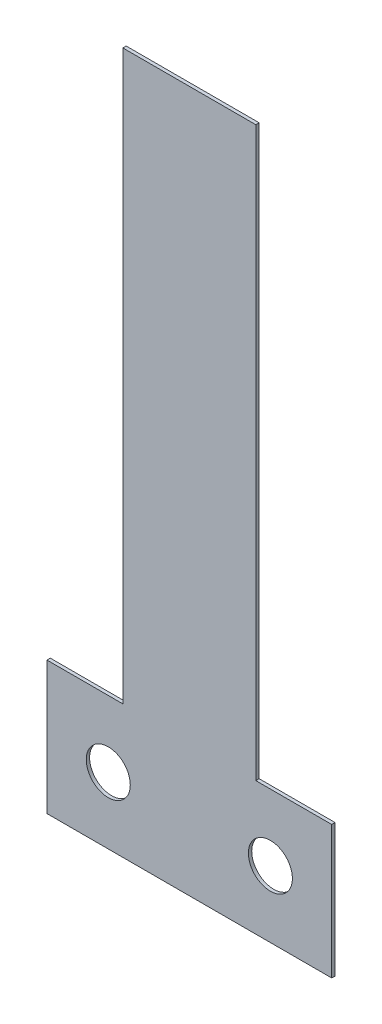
SolidWorks part; units mm, degrees
ref_plane "Front Plane" through (0, 0, 0) normal (0, 0, 1) x (1, 0, 0)
ref_plane "Top Plane" through (0, 0, 0) normal (0, 1, 0) x (1, 0, 0)
ref_plane "Right Plane" through (0, 0, 0) normal (1, 0, 0) x (0, 0, -1)
sketch "Sketch1" plane through (0, 0, 0) normal (0, 0, 1) x (1, 0, 0)
  line L0 (0, 0) -> (0, 62.1903) construction
  line L2 (-11.9126, -5.5626) -> (11.9126, -5.5626)
  line L3 (-11.9126, -5.5626) -> (-11.9126, 5.5626)
  line L4 (-11.9126, 5.5626) -> (11.9126, 5.5626)
  line L5 (11.9126, -5.5626) -> (11.9126, 5.5626)
  line L6 (-11.9126, -5.5626) -> (11.9126, 5.5626) construction
  line L7 (-11.9126, 5.5626) -> (11.9126, -5.5626) construction
  point P3 (0, 0)
  dimension "D1" = 23.8252
  dimension "D2" = 11.1252
extrude "Boss-Extrude1" add sketch "Sketch1" along normal blind 0.2794
sketch "Sketch2" plane through (0, 0, 0.2794) normal (0, 0, 1) x (1, 0, 0)
  line L0 (0, 0) -> (0, 55.1175) construction
  line L1 (11.9126, 5.5626) -> (-11.9126, 5.5626) construction
  line L2 (-5.5626, 53.086) -> (5.5626, 53.086)
  line L3 (-5.5626, 53.086) -> (-5.5626, 5.5626)
  line L4 (-5.5626, 5.5626) -> (5.5626, 5.5626)
  line L5 (5.5626, 53.086) -> (5.5626, 5.5626)
  line L6 (-5.5626, 53.086) -> (5.5626, 5.5626) construction
  line L7 (-5.5626, 5.5626) -> (5.5626, 53.086) construction
  point P3 (0, 29.3243)
  dimension "D1" = 11.1252
  dimension "D2" = 47.5234
extrude "Boss-Extrude2" add sketch "Sketch2" against normal blind 0.2794
sketch "Sketch3" plane through (0, 0, 0.2794) normal (0, 0, 1) x (1, 0, 0)
  line L0 (0, 0) -> (0, 14.2548) construction
  line L1 (-8.4035, 0) -> (5.5464, 0) construction
  line L3 (-11.9126, 5.5626) -> (-11.9126, -5.5626) construction
  circle A0 centre (-6.7818, 0) radius 1.8415
  circle A1 centre (6.7818, 0) radius 1.8415
  point P11 (-11.9126, 0)
  dimension "D1" = 3.683
  dimension "D2" = 13.5636
extrude "Cut-Extrude1" cut sketch "Sketch3" against normal blind 0.2794
